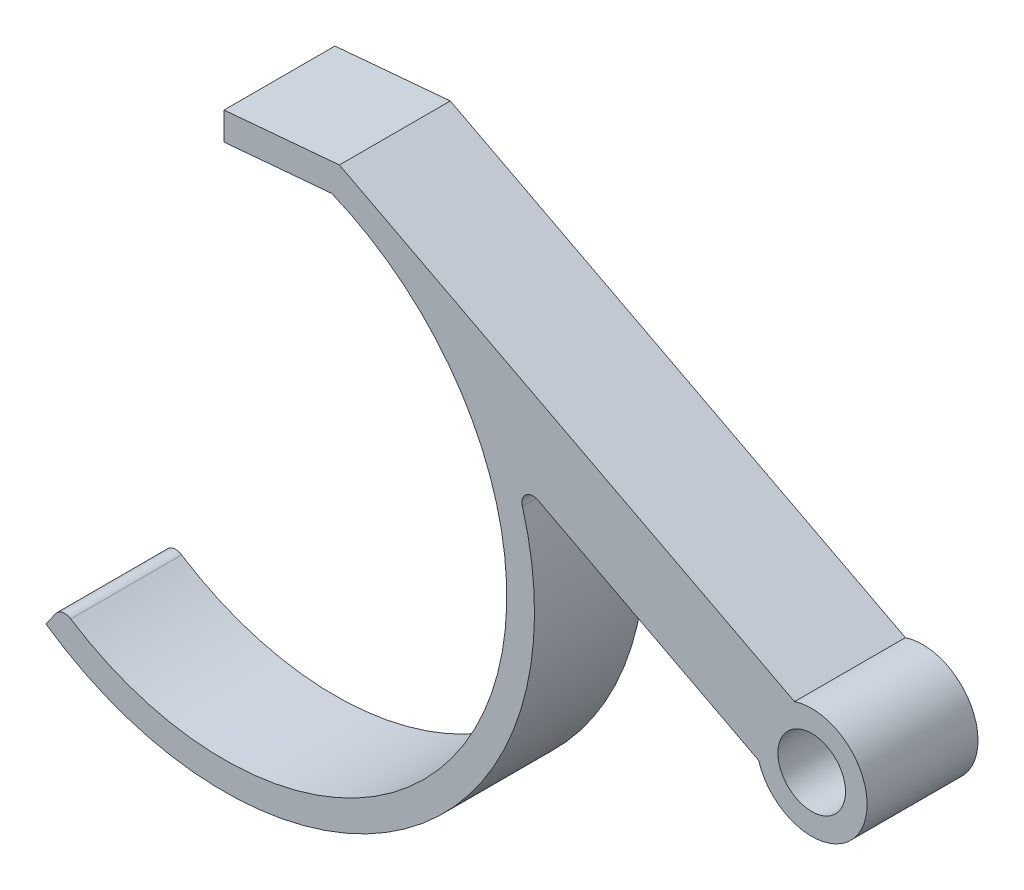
SolidWorks part; units mm, degrees
ref_plane "Front Plane" through (0, 0, 0) normal (0, 0, 1) x (1, 0, 0)
ref_plane "Top Plane" through (0, 0, 0) normal (0, 1, 0) x (1, 0, 0)
ref_plane "Right Plane" through (0, 0, 0) normal (1, 0, 0) x (0, 0, -1)
sketch "Sketch1" plane through (0, 0, 0) normal (0, 0, 1) x (1, 0, 0)
  line L1 (-15.1889, -21.6921) -> (-16.0601, -22.9363)
  line L2 (12.5952, 25.0072) -> (13.2863, 24.647)
  line L3 (51.4513, 4.7541) -> (13.2863, 24.647)
  line L4 (48.2159, -1.4533) -> (28.3297, 8.9121)
  line L5 (0, 0) -> (0, 22.73)
  line L6 (0, 22.73) -> (9.7088, 23.5794)
  line L7 (-8.1484, 24.5267) -> (-6.4242, 24.6775)
  line L8 (0, 22.73) -> (0, 25.2395)
  line L9 (0, 25.2395) -> (10.4033, 26.1497)
  line L10 (-8.1484, 24.5267) -> (22.6619, 27.2222) construction
  line L11 (-7.9305, 22.0362) -> (22.8798, 24.7317) construction
  line L16 (12.5952, 25.0072) -> (10.4033, 26.1497)
  arc A0 (-13.8275, -21.4254) -> (9.7088, 23.5794) centre (0, 0) ccw
  arc A1 (-16.0601, -22.9363) -> (26.9065, 7.7486) centre (0, 0) ccw
  circle A2 centre (53, 0) radius 3.05
  arc A3 (48.2159, -1.4533) -> (51.4513, 4.7541) centre (53, 0) ccw
  circle A4 centre (0, 0) radius 28 construction
  circle A5 centre (0, 0) radius 25.5 construction
  arc A6 (-13.8275, -21.4254) -> (-15.1889, -21.6921) centre (-14.3698, -22.2656) ccw
  arc A7 (28.3297, 8.9121) -> (26.9065, 7.7486) centre (27.8674, 8.0253) ccw
  dimension "D1" = 51
  dimension "D5" = 6.1
  dimension "D6" = 10
  dimension "D4" = 1
  dimension "D3" = 53
  dimension "D10" = 22.73
  dimension "D2" = 2.5
  dimension "D12" = 2.5
extrude "Boss-Extrude1" add sketch "Sketch1" along normal blind 10 contours A7 L4 A3 L3 L2 L16 L9 L8 L6 A0 A6 L1 A1 A2
